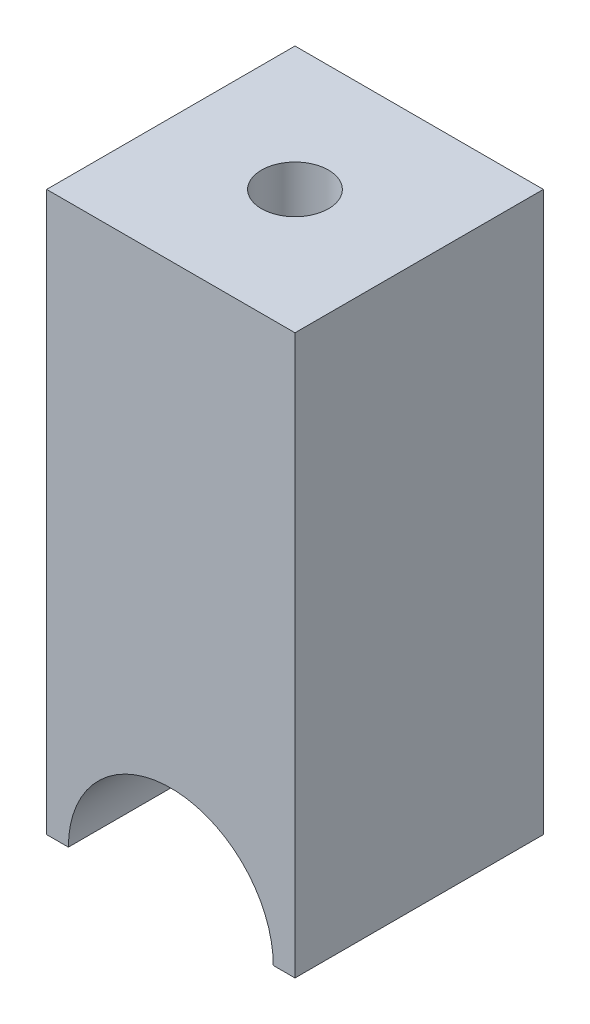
SolidWorks part; units mm, degrees
ref_plane "Front Plane" through (0, 0, 0) normal (0, 0, 1) x (1, 0, 0)
ref_plane "Top Plane" through (0, 0, 0) normal (0, 1, 0) x (1, 0, 0)
ref_plane "Right Plane" through (0, 0, 0) normal (1, 0, 0) x (0, 0, -1)
sketch "Sketch1" plane through (0, 0, 0) normal (0, 1, 0) x (1, 0, 0)
  line L1 (-12.7, 12.7) -> (12.7, 12.7)
  line L2 (-12.7, 12.7) -> (-12.7, -12.7)
  line L3 (-12.7, -12.7) -> (12.7, -12.7)
  line L4 (12.7, 12.7) -> (12.7, -12.7)
  dimension "D1" = 25.4
  dimension "D2" = 25.4
  dimension "D3" = 12.7
  dimension "D4" = 12.7
extrude "Extrude1" add sketch "Sketch1" along normal blind 57.15
sketch "Sketch2" plane through (0, 0, 12.7) normal (0, 0, 1) x (1, 0, 0)
  circle A0 centre (0, 0) radius 10.4775
extrude "Cut-Extrude1" cut sketch "Sketch2" against normal through all
sketch "Sketch3" plane through (0, 57.15, 0) normal (0, 1, 0) x (-1, 0, 0)
  circle A0 centre (0, 0) radius 3.429
  dimension "D1" = 6.858
extrude "Cut-Extrude2" cut sketch "Sketch3" against normal through all
